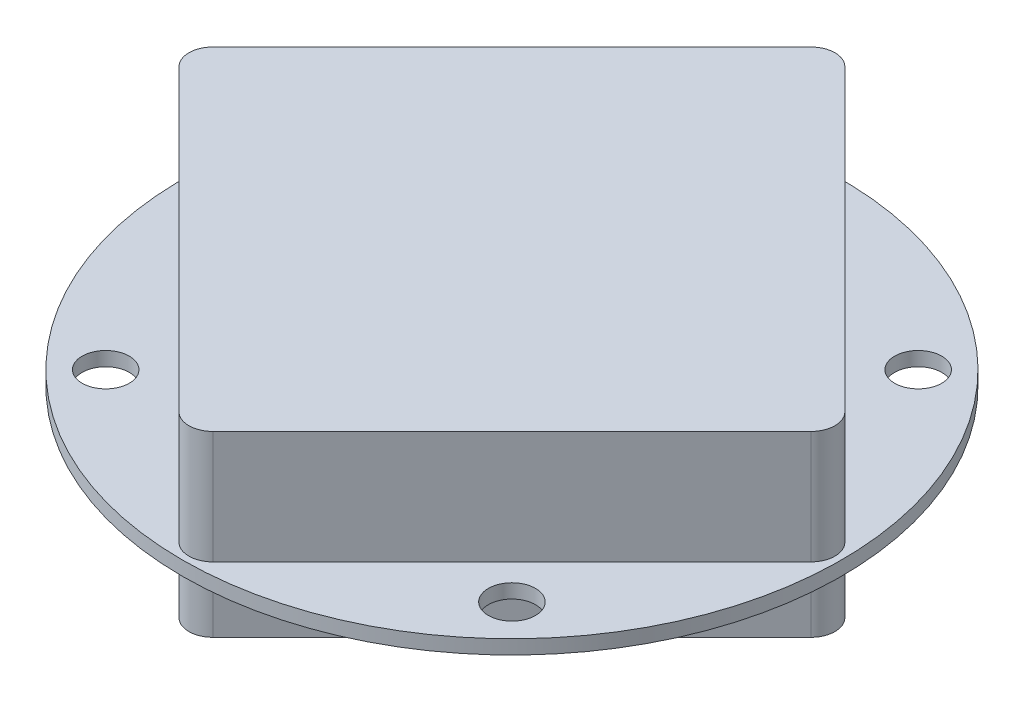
SolidWorks part; units mm, degrees
ref_plane "Front Plane" through (0, 0, 0) normal (0, 0, 1) x (1, 0, 0)
ref_plane "Top Plane" through (0, 0, 0) normal (0, 1, 0) x (1, 0, 0)
ref_plane "Right Plane" through (0, 0, 0) normal (1, 0, 0) x (0, 0, -1)
sketch "Sketch1" plane through (0, 0, 0) normal (0, 1, 0) x (1, 0, 0)
  circle A0 centre (0, 0) radius 17.5
  dimension "D1" = 35
extrude "Boss-Extrude1" add sketch "Sketch1" along normal blind 0.75
sketch "Sketch2" plane through (0, 0.75, 0) normal (0, 1, 0) x (1, 0, 0)
  line L0 (-16.7796, 0.898) -> (-0.898, 16.7796)
  line L1 (-16.7796, -0.898) -> (-0.898, -16.7796)
  line L2 (0.898, 16.7796) -> (16.7796, 0.898)
  line L3 (0.898, -16.7796) -> (16.7796, -0.898)
  line L4 (-17.6777, 0) -> (17.6777, 0) construction
  line L5 (0, 17.6777) -> (0, -17.6777) construction
  arc A0 (-16.7796, -0.898) -> (-16.7796, 0.898) centre (-15.8816, 0) cw
  arc A1 (-0.898, -16.7796) -> (0.898, -16.7796) centre (0, -15.8816) ccw
  arc A2 (16.7796, 0.898) -> (16.7796, -0.898) centre (15.8816, 0) cw
  arc A3 (-0.898, 16.7796) -> (0.898, 16.7796) centre (0, 15.8816) cw
  point P1 (0, 0)
  dimension "D3" = 1.27
  dimension "D1" = 25
  dimension "D2" = 25
extrude "Boss-Extrude2" add sketch "Sketch2" along normal blind 6
sketch "Sketch3" plane through (0, 0, 0) normal (0, -1, 0) x (1, 0, 0)
  line L18 (16.7796, -0.898) -> (0.898, -16.7796)
  line L19 (-0.898, -16.7796) -> (-16.7796, -0.898)
  line L20 (-16.7796, 0.898) -> (-0.898, 16.7796)
  line L21 (16.7796, -0.898) -> (0.898, -16.7796)
  line L22 (-0.898, -16.7796) -> (-16.7796, -0.898)
  line L23 (-16.7796, 0.898) -> (-0.898, 16.7796)
  line L24 (16.7796, 0.898) -> (0.898, 16.7796)
  line L25 (16.7796, 0.898) -> (0.898, 16.7796)
  arc A13 (-16.7796, 0.898) -> (-16.7796, -0.898) centre (-15.8816, 0) ccw
  arc A14 (-0.898, -16.7796) -> (0.898, -16.7796) centre (0, -15.8816) ccw
  arc A15 (-16.7796, 0.898) -> (-16.7796, -0.898) centre (-15.8816, 0) ccw
  arc A16 (-0.898, -16.7796) -> (0.898, -16.7796) centre (0, -15.8816) ccw
  arc A21 (16.7796, -0.898) -> (16.7796, 0.898) centre (15.8816, 0) ccw
  arc A22 (0.898, 16.7796) -> (-0.898, 16.7796) centre (0, 15.8816) ccw
  arc A23 (16.7796, -0.898) -> (16.7796, 0.898) centre (15.8816, 0) ccw
  arc A24 (0.898, 16.7796) -> (-0.898, 16.7796) centre (0, 15.8816) ccw
  dimension "D1" = 0
  dimension "D2" = 0
extrude "Boss-Extrude3" add sketch "Sketch3" along normal blind 2.72
hole_wizard "Ø2.5 (2.5) Diameter Hole1" positions "Sketch5" profile "Sketch4" hole size "Ø2.5" standard "ANSI Metric"
sketch "Sketch5" plane through (0, 0.75, 0) normal (0, 1, 0) x (1, 0, 0)
  line L0 (10.7854, 10.7854) -> (-10.7854, -10.7854) construction
  line L1 (-10.6805, 10.6805) -> (10.6805, -10.6805) construction
  line L2 (0, 0) -> (11.6029, 0) construction
  point P0 (-10.6805, 10.6805)
  point P2 (10.7854, 10.7854)
  point P4 (10.6805, -10.6805)
  point P6 (-10.7854, -10.7854)
  dimension "D1" = 45
sketch "Sketch4" plane through (-10.6805, 0.75, -10.6805) normal (1, 0, 0) x (0, 0, 1)
  line L0 (0, 0) -> (0, 3.47)
  line L1 (0, 3.47) -> (1.25, 3.47)
  line L2 (1.25, 3.47) -> (1.25, 0)
  line L5 (1.25, 0) -> (0, 0)
  line L11 (0, -6.35) -> (0, 107.95) construction
  dimension "Thru Hole Dia." = 2.5
  dimension "Thru Hole Depth" = 3.47
sketch "Sketch22" plane through (0, 0, 0) normal (0, 0, 1) x (1, 0, 0)
  line L0 (0, -1.35) -> (17.1516, -1.36) construction
  line L1 (22.1487, -6.36) -> (22.1487, -133.36)
  line L5 (0, -2.72) -> (0, 0) construction
  line L6 (17.1516, -2.72) -> (17.1516, 0) construction
  arc A0 (17.1516, -1.36) -> (22.1487, -6.36) centre (17.1487, -6.36) cw
  dimension "D2" = 5
  dimension "D1" = 1.35
  dimension "D4" = 127
ref_plane "Plane12" through (17.1516, 0, 0) normal (1, 0, 0) x (0, 0, -1)
sketch "Sketch23" plane through (17.1516, 0, 0) normal (1, 0, 0) x (0, 0, -1)
  circle A0 centre (0, -1.36) radius 0.69
  dimension "D1" = 1.38
sweep "Sweep6" [suppressed] add profiles "Sketch23" path "Sketch22"
